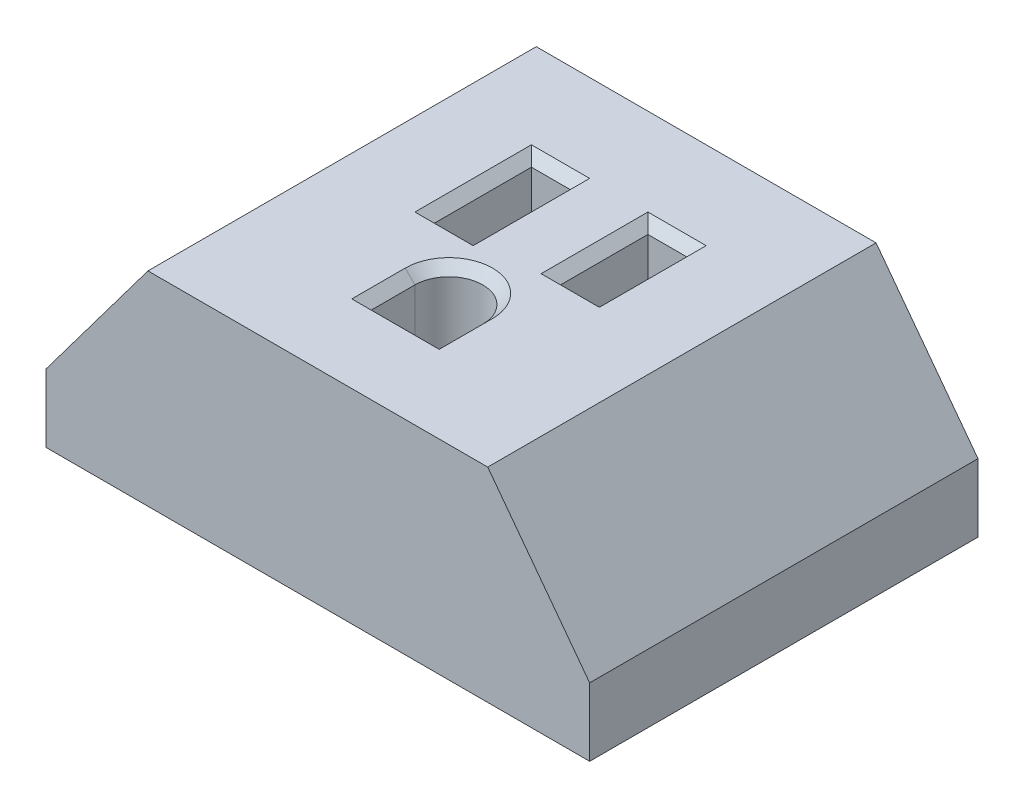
SolidWorks part; units mm, degrees
ref_plane "Front" through (0, 0, 0) normal (0, 0, 1) x (1, 0, 0)
ref_plane "Top" through (0, 0, 0) normal (0, 1, 0) x (1, 0, 0)
ref_plane "Right" through (0, 0, 0) normal (1, 0, 0) x (0, 0, -1)
sketch "Sketch3" plane through (0, 0, 0) normal (0, 0, 1) x (1, 0, 0)
  line L0 (28, 7) -> (17.5, 21)
  line L1 (-28, 0) -> (28, 0)
  line L2 (-28, 0) -> (-28, 7)
  line L3 (-17.5, 21) -> (17.5, 21)
  line L4 (28, 0) -> (28, 7)
  line L5 (-28, 7) -> (-17.5, 21)
  line L6 (0, 0) -> (0, 21) construction
  dimension "D1" = 56
  dimension "D2" = 35
  dimension "D3" = 21
  dimension "D4" = 7
extrude "Base-Extrude" add sketch "Sketch3" against normal blind 40
sketch "Sketch2" plane through (0, 21, 0) normal (0, 1, 0) x (1, 0, 0)
  line L0 (-4, 30) -> (4, 30) construction
  line L1 (-8, 30) -> (-4, 30)
  line L2 (-8, 30) -> (-8, 20)
  line L3 (-8, 20) -> (-4, 20)
  line L4 (-4, 30) -> (-4, 20)
  line L5 (4, 30) -> (8, 30)
  line L6 (4, 30) -> (4, 21)
  line L7 (4, 21) -> (8, 21)
  line L8 (8, 30) -> (8, 21)
  line L9 (0, 30) -> (0, 0) construction
  line L10 (-3.5, 9) -> (3.5, 9)
  line L11 (3.5, 9) -> (3.5, 13.5)
  line L12 (-3.5, 9) -> (-3.5, 13.5)
  line L13 (17.5, 0) -> (-17.5, 0) construction
  arc A0 (3.5, 13.5) -> (-3.5, 13.5) centre (0, 13.5) ccw
  dimension "D7" = 8
  dimension "D1" = 8
  dimension "D2" = 4
  dimension "D3" = 10
  dimension "D4" = 9
  dimension "D5" = 11
  dimension "D6" = 7
  dimension "D8" = 30
extrude "Cut-Extrude1" cut sketch "Sketch2" against normal up to next
chamfer "Chamfer1" distance 1 angle 45 11 edges at (-8, 21, -25) (-4, 21, -25) (-6, 21, -30) (4, 21, -25.5) (6, 21, -21) (8, 21, -25.5) (6, 21, -30) (3.5, 21, -11.25) (0, 21, -17) (-3.5, 21, -11.25) (0, 21, -9)
